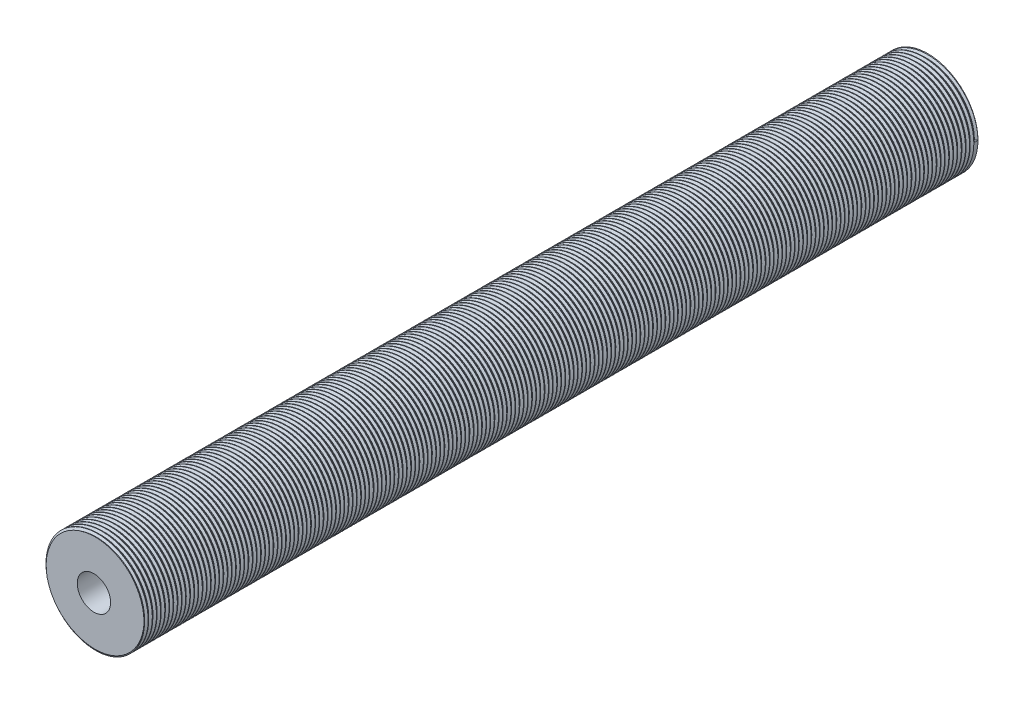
SolidWorks part; units mm, degrees
ref_plane "Front Plane" through (0, 0, 0) normal (0, 0, 1) x (1, 0, 0)
ref_plane "Top Plane" through (0, 0, 0) normal (0, 1, 0) x (1, 0, 0)
ref_plane "Right Plane" through (0, 0, 0) normal (1, 0, 0) x (0, 0, -1)
sketch "Sketch1" plane through (0, 0, 0) normal (0, 0, 1) x (1, 0, 0)
  circle A0 centre (0, 0) radius 3
  circle A1 centre (0, 0) radius 1
  dimension "D1" = 6
  dimension "D2" = 2
extrude "Boss-Extrude1" add sketch "Sketch1" along normal blind 50 contours A0 A1
thread "Thread1" pitch 0.25 start angle 0, offset 0, length 0, pitch 0.25, diameter 6
ref_plane "Plane1" through (3, 0, 0) normal (0, -1, 0) x (1, 0, 0)
sketch "Thread Profile1" plane through (3, 0, 0) normal (0, -1, 0) x (1, 0, 0)
  line L0 (0, 0) -> (0, 0.25) construction
  line L11 (0, 0) -> (0, 0.2187)
  line L12 (0, 0.2187) -> (-0.1353, 0.1406)
  line L13 (-0.1353, 0.1406) -> (-0.1353, 0.0781)
  line L15 (-0.1353, 0.0781) -> (0, 0)
  line L17 (-0.1353, 0.1094) -> (0, 0.1094) construction
  point P2 (0, 0)
  dimension "Pitch" = 0.25
  dimension "Profile_Angle" = 60
  dimension "Profile_Land" = 0.0625
  dimension "Profile_Height" = 0.1353
